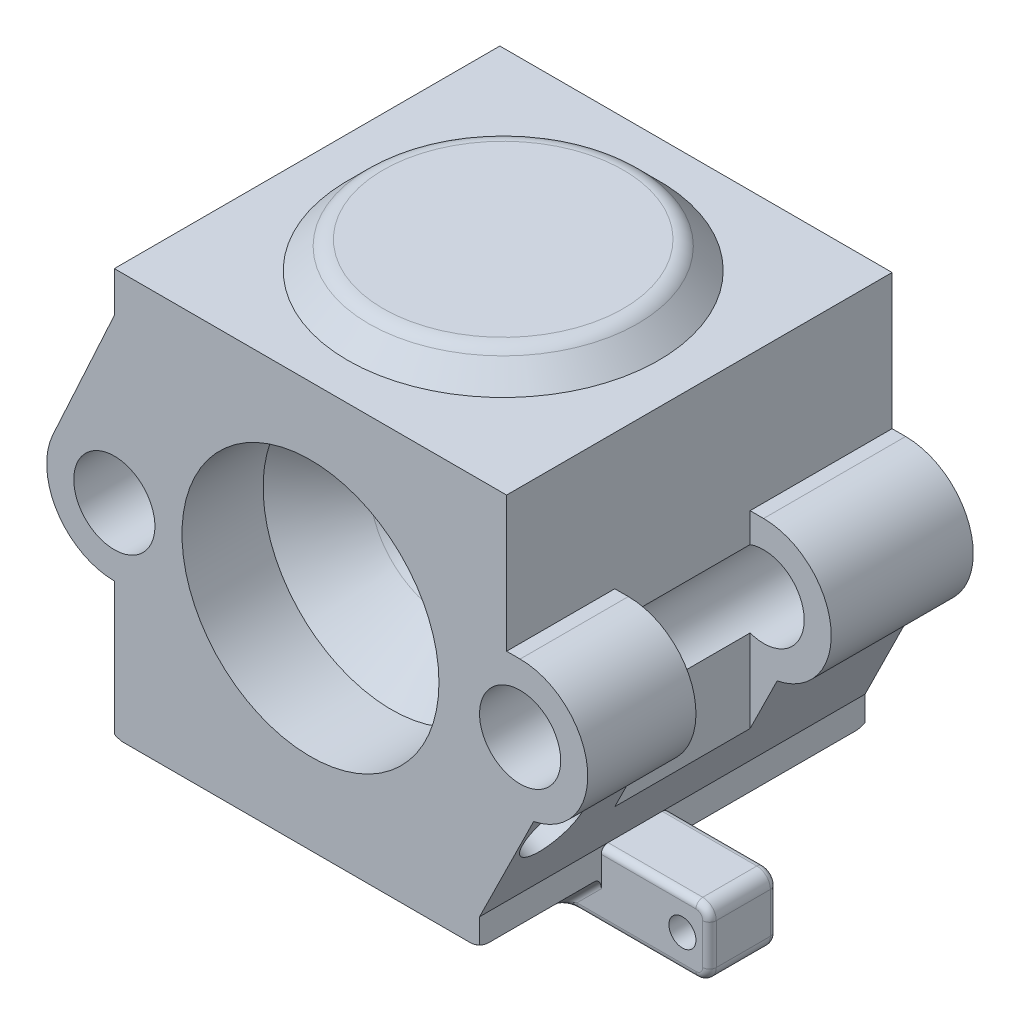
SolidWorks part; units mm, degrees
ref_plane "Plan de face" through (0, 0, 0) normal (0, 0, 1) x (1, 0, 0)
ref_plane "Plan de dessus" through (0, 0, 0) normal (0, 1, 0) x (1, 0, 0)
ref_plane "Plan de droite" through (0, 0, 0) normal (1, 0, 0) x (0, 0, -1)
sketch "Esquisse1" plane through (0, 0, 0) normal (0, 0, 1) x (1, 0, 0)
  line L2 (0, 8) -> (0, 0)
  line L3 (0, 0) -> (27, 0)
  line L5 (0, 25) -> (-4.5453, 15.0833)
  line L6 (0, 25) -> (0, 28)
  line L7 (0, 28) -> (29, 28)
  line L8 (29, 28) -> (29, 18)
  line L9 (29, 18) -> (30, 18)
  line L10 (27, 0) -> (31, 8.101)
  arc A0 (-4.5453, 15.0833) -> (0, 8) centre (0, 13) ccw
  arc A1 (30, 18) -> (31, 8.101) centre (30, 13) cw
  circle A2 centre (0, 13) radius 3
  circle A3 centre (30, 13) radius 3
  point P14 (27, 13)
  dimension "D1" = 5
  dimension "D2" = 5
  dimension "D6" = 6
  dimension "D7" = 6
  dimension "D3" = 29
  dimension "D4" = 1
  dimension "D5" = 28
  dimension "D8" = 3
  dimension "D9" = 10
  dimension "D10" = 8
  dimension "D11" = 4
extrude "Boss.-Extru.1" add sketch "Esquisse1" along normal blind 28.5
sketch "Esquisse2" plane through (0, 28, 0) normal (0, 1, 0) x (1, 0, 0)
  line L0 (29, 0) -> (0, 0) construction
  line L1 (14.5, -14.25) -> (14.5, 0) construction
  line L2 (14.5, -14.25) -> (29, -14.25) construction
  line L3 (29, -28.5) -> (29, 0) construction
  circle A0 centre (14.5, -14.25) radius 11.5
  dimension "D1" = 23
extrude "Boss.-Extru.3" add sketch "Esquisse2" along normal blind 2 contours A0
chamfer "Chanfrein1" distance 2 angle 45 1 edges at (14.5, 30, 25.75)
fillet "Congé1" radius 1.5 1 edges at (14.5, 30, 23.75)
sketch "Esquisse3" plane through (0, 28, 0) normal (0, 1, 0) x (1, 0, 0)
  line L0 (35, -28.5) -> (35, 0) construction
  line L1 (35, -10.5) -> (29, -10.5)
  line L2 (35, -10.5) -> (35, -20.5)
  line L3 (35, -20.5) -> (29, -20.5)
  line L4 (29, -10.5) -> (29, -20.5)
  line L5 (29, -28.5) -> (29, 0) construction
  line L6 (0, -28.5) -> (27, -28.5) construction
  dimension "D1" = 10
  dimension "D2" = 8
extrude "Enlèv. mat.-Extru.1" cut sketch "Esquisse3" against normal through all
sketch "Esquisse4" plane through (0, 0, 0) normal (0, -1, 0) x (1, 0, 0)
  line L0 (27, 19.5) -> (27, 28.5)
  line L1 (27, 19.5) -> (35, 19.5)
  line L3 (27, 14.5) -> (35, 14.5)
  line L4 (0, 0) -> (27, 0)
  line L5 (27, 0) -> (27, 28.5)
  line L6 (27, 28.5) -> (0, 28.5)
  line L7 (0, 28.5) -> (0, 0)
  line L8 (0, 0) -> (27, 0)
  line L9 (27, 0) -> (27, 14.5)
  line L10 (27, 28.5) -> (0, 28.5)
  line L11 (0, 28.5) -> (0, 0)
  line L12 (35, 19.5) -> (35, 14.5)
  dimension "D2" = 5
  dimension "D3" = 8
  dimension "D4" = 9
  dimension "D1" = 0
extrude "Boss.-Extru.4" add sketch "Esquisse4" along normal blind 5
chamfer "Chanfrein2" distance 3 angle 45 5 edges at (27, -5, 24) (27, -5, 7.25) (13.5, -5, 0) (0, -5, 14.25) (13.5, -5, 28.5)
fillet "Congé2" radius 1 6 edges at (35, 0, 17) (35, -5, 17) (1.5, -3.5, 1.5) (25.5, -3.5, 1.5) (25.5, -3.5, 27) (1.5, -3.5, 27)
fillet "Congé3" radius 0.5 21 edges at (30.5, 0, 19.5) (34.7071, -0.2929, 19.5) (35, -2.5, 19.5) (34.7071, -4.7071, 19.5) (30.5, 0, 14.5) (34.7071, -0.2929, 14.5) (35, -2.5, 14.5) (34.7071, -4.7071, 14.5) (24, -5, 9.1036) (13.5, -5, 3) (3, -5, 14.25) (13.5, -5, 25.5) (24, -5, 22.1464) (29, -5, 19.5) (29, -5, 14.5) (25.5, -3.5, 14.5) (25.5, -3.5, 19.5) (3.1895, -5, 25.3105) (23.8105, -5, 25.3105) (23.8105, -5, 3.1895) (3.1895, -5, 3.1895)
sketch "Esquisse5" plane through (0, 0, 28.5) normal (0, 0, 1) x (1, 0, 0)
  line L0 (29, 28) -> (0, 28) construction
  circle A0 centre (14.5, 13.5025) radius 9.5
  arc A3 (31, 8.101) -> (30, 18) centre (30, 13) ccw construction
  point P5 (14.5, 28)
  point P14 (34.9747, 13.5025)
  dimension "D1" = 19
extrude "Enlèv. mat.-Extru.2" cut sketch "Esquisse5" against normal blind 6
sketch "Esquisse6" plane through (0, 0, 22.5) normal (0, 0, 1) x (1, 0, 0)
  circle A0 centre (14.5, 13.5025) radius 4.5
  dimension "D1" = 9
extrude "Enlèv. mat.-Extru.3" cut sketch "Esquisse6" against normal through all
chamfer "Chanfrein3" distance 5 angle 45 1 edges at (19, 13.5025, 22.5)
sketch "Esquisse7" plane through (0, 0, 0) normal (0, 0, -1) x (-1, 0, 0)
  circle A0 centre (-14.5, 13.5025) radius 7
  dimension "D1" = 14
extrude "Enlèv. mat.-Extru.4" cut sketch "Esquisse7" against normal blind 14
chamfer "Chanfrein4" distance 3 angle 45 1 edges at (10, 13.5025, 14)
fillet "Congé4" radius 5 1 edges at (19, 13.5025, 17.5)
fillet "Congé6" radius 1 1 edges at (10, 13.5025, 17)
sketch "Esquisse8" plane through (0, 0, 19.5) normal (0, 0, 1) x (1, 0, 0)
  line L0 (34.5, -4) -> (34.5, -1) construction
  line L1 (35, -1) -> (35, -4) construction
  circle A0 centre (33, -2.5) radius 1
  point P5 (34.5, -2.5)
  dimension "D1" = 2
  dimension "D2" = 2
extrude "Enlèv. mat.-Extru.5" cut sketch "Esquisse8" against normal through all
sketch "Esquisse9" plane through (21.7076, -10.7185, 0) normal (0.8967, -0.4427, 0) x (0, 0, -1)
  line L0 (-14.5, 18.5268) -> (0, 18.5268) construction
  line L2 (-22.5, 18.5268) -> (-28.5, 18.5268) construction
  line L3 (-28.5, 11.9539) -> (-28.5, 20.9886) construction
  circle A0 centre (-26, 18.5268) radius 2.25
  dimension "D1" = 4.5
  dimension "D2" = 2.5
extrude "Enlèv. mat.-Extru.6" cut sketch "Esquisse9" against normal blind 10
